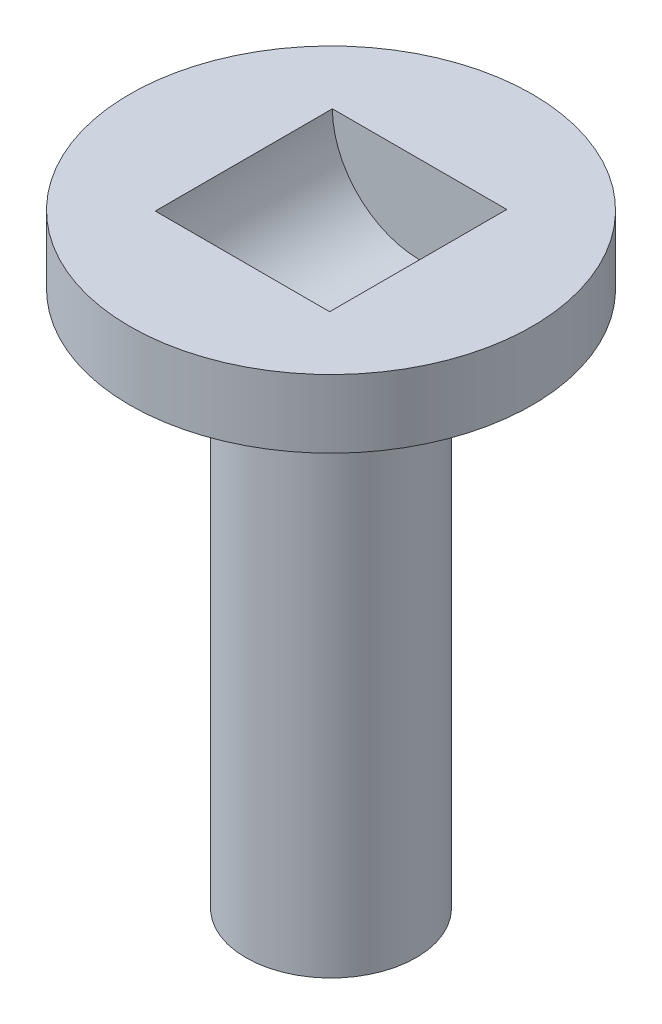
SolidWorks part; units mm, degrees
ref_plane "Front Plane" through (0, 0, 0) normal (0, 0, 1) x (1, 0, 0)
ref_plane "Top Plane" through (0, 0, 0) normal (0, 1, 0) x (1, 0, 0)
ref_plane "Right Plane" through (0, 0, 0) normal (1, 0, 0) x (0, 0, -1)
sketch "Sketch1" plane through (0, 0, 0) normal (0, 1, 0) x (1, 0, 0)
  circle A0 centre (0, 0) radius 3.175
  dimension "D1" = 6.35
extrude "Boss-Extrude1" add sketch "Sketch1" along normal blind 20
sketch "Sketch2" plane through (0, 0, 0) normal (0, -1, 0) x (1, 0, 0)
  circle A0 centre (0, 0) radius 1.35
  dimension "D1" = 2.7
extrude "Cut-Extrude1" cut sketch "Sketch2" against normal blind 10
sketch "Sketch4" plane through (0, 20, 0) normal (0, 1, 0) x (1, 0, 0)
  circle A0 centre (0, 0) radius 7.5
  dimension "D1" = 15
extrude "Boss-Extrude2" add sketch "Sketch4" along normal blind 2.54
sketch "Sketch6" plane through (0, 22.54, 0) normal (0, 1, 0) x (1, 0, 0)
  circle A0 centre (0, 0) radius 4.85
  dimension "D1" = 9.7
extrude "Boss-Extrude3" add sketch "Sketch6" against normal blind 3.35
sketch "Sketch5" plane through (0, 0, 0) normal (0, 0, 1) x (1, 0, 0)
  line L0 (7.5, 22.54) -> (-7.5, 22.54) construction
  circle A0 centre (0, 22.54) radius 3.25
  dimension "D1" = 6.5
extrude "Cut-Extrude3" cut sketch "Sketch5" against normal blind 3.302 and the other way blind 3.3
